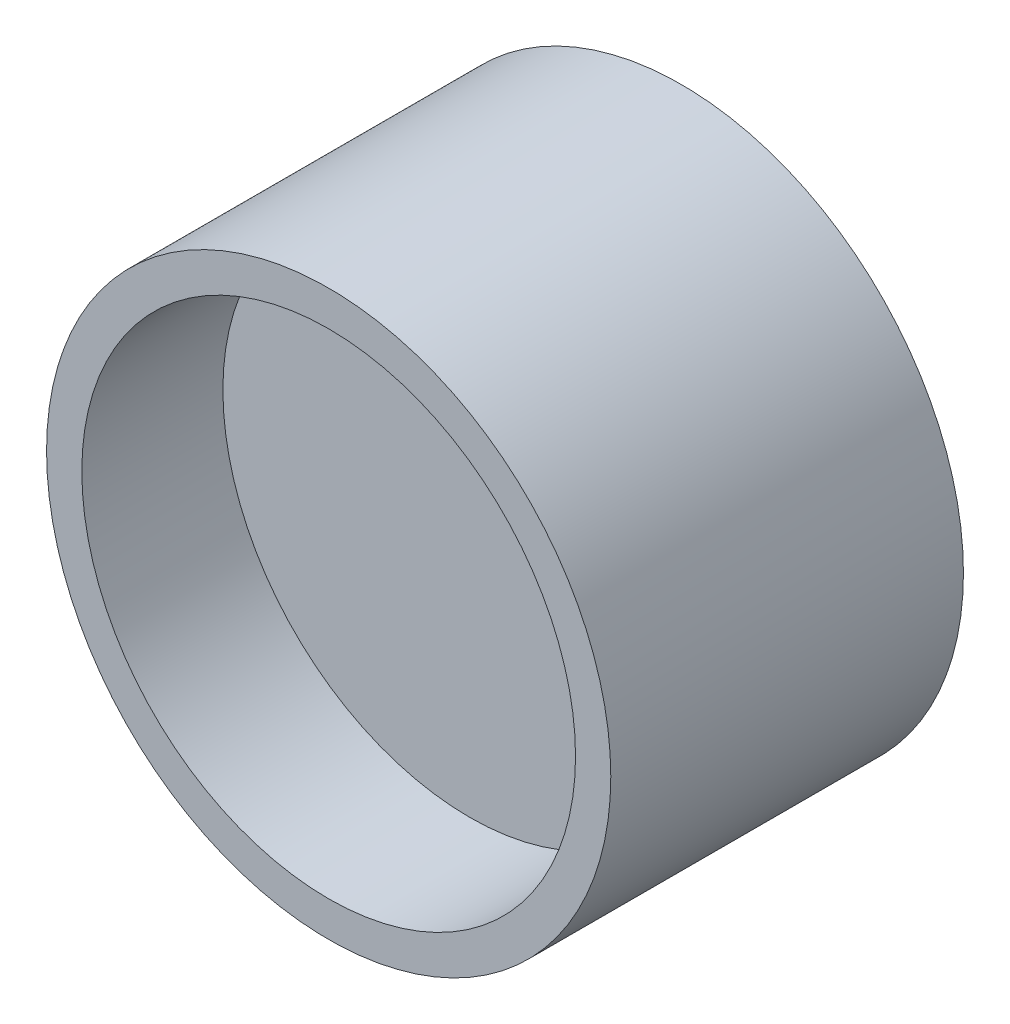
SolidWorks part; units mm, degrees
ref_plane "Front Plane" through (0, 0, 0) normal (0, 0, 1) x (1, 0, 0)
ref_plane "Top Plane" through (0, 0, 0) normal (0, 1, 0) x (1, 0, 0)
ref_plane "Right Plane" through (0, 0, 0) normal (1, 0, 0) x (0, 0, -1)
sketch "Sketch1" plane through (0, 0, 0) normal (0, 0, 1) x (1, 0, 0)
  circle A0 centre (0, 0) radius 40
  dimension "D1" = 80
extrude "Boss-Extrude1" add sketch "Sketch1" along normal blind 50
sketch "Sketch2" plane through (0, 0, 50) normal (0, 0, 1) x (1, 0, 0)
  circle A0 centre (0, 0) radius 35
  dimension "D1" = 70
sketch "Sketch4" plane through (0, 0, 50) normal (0, 0, 1) x (1, 0, 0)
extrude "Cut-Extrude1" cut sketch "Sketch2" against normal blind 20
